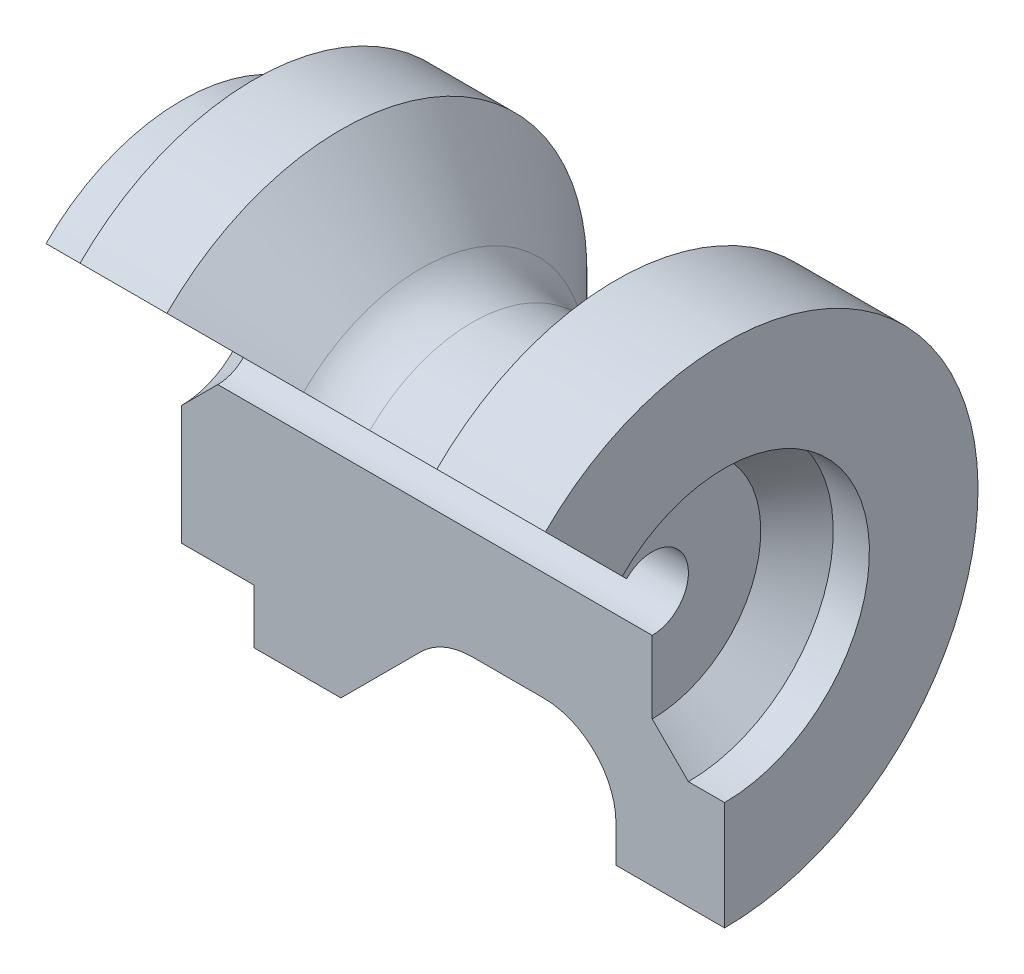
SolidWorks part; units mm, degrees
ref_plane "Front Plane" through (0, 0, 0) normal (0, 0, 1) x (1, 0, 0)
ref_plane "Top Plane" through (0, 0, 0) normal (0, 1, 0) x (1, 0, 0)
ref_plane "Right Plane" through (0, 0, 0) normal (1, 0, 0) x (0, 0, -1)
sketch "Sketch1" plane through (0, 0, 0) normal (0, 0, 1) x (1, 0, 0)
  line L0 (0, 0) -> (90, 0) construction
  line L1 (5, 5) -> (0, 10)
  line L2 (0, 10) -> (0, 26.4858)
  line L3 (0, 26.4858) -> (10, 26.4858)
  line L4 (10, 26.4858) -> (10, 33.987)
  line L5 (10, 33.987) -> (22, 33.987)
  line L6 (22, 33.987) -> (33.058, 22.9289)
  line L7 (40.1291, 20) -> (50, 20)
  line L8 (60, 30) -> (60, 35)
  line L9 (60, 35) -> (75, 35)
  line L10 (75, 35) -> (75, 20)
  line L11 (75, 20) -> (70, 20)
  line L12 (65, 15) -> (65, 5)
  line L13 (70, 20) -> (65, 15)
  line L17 (65, 5) -> (5, 5)
  arc A0 (33.058, 22.9289) -> (40.1291, 20) centre (40.1291, 30) ccw
  arc A1 (50, 20) -> (60, 30) centre (50, 30) ccw
  point P15 (65, 20)
  dimension "D2" = 10
  dimension "D1" = 5
  dimension "D3" = 10
  dimension "D4" = 35
  dimension "D5" = 20
  dimension "D6" = 5
  dimension "D9" = 75
  dimension "D10" = 26.4858
  dimension "D11" = 135
  dimension "D12" = 5
  dimension "D13" = 10
  dimension "D14" = 12
  dimension "D15" = 33.987
  dimension "D16" = 15
revolve "Revolve1" add sketch "Sketch1" angle 180 about L0
